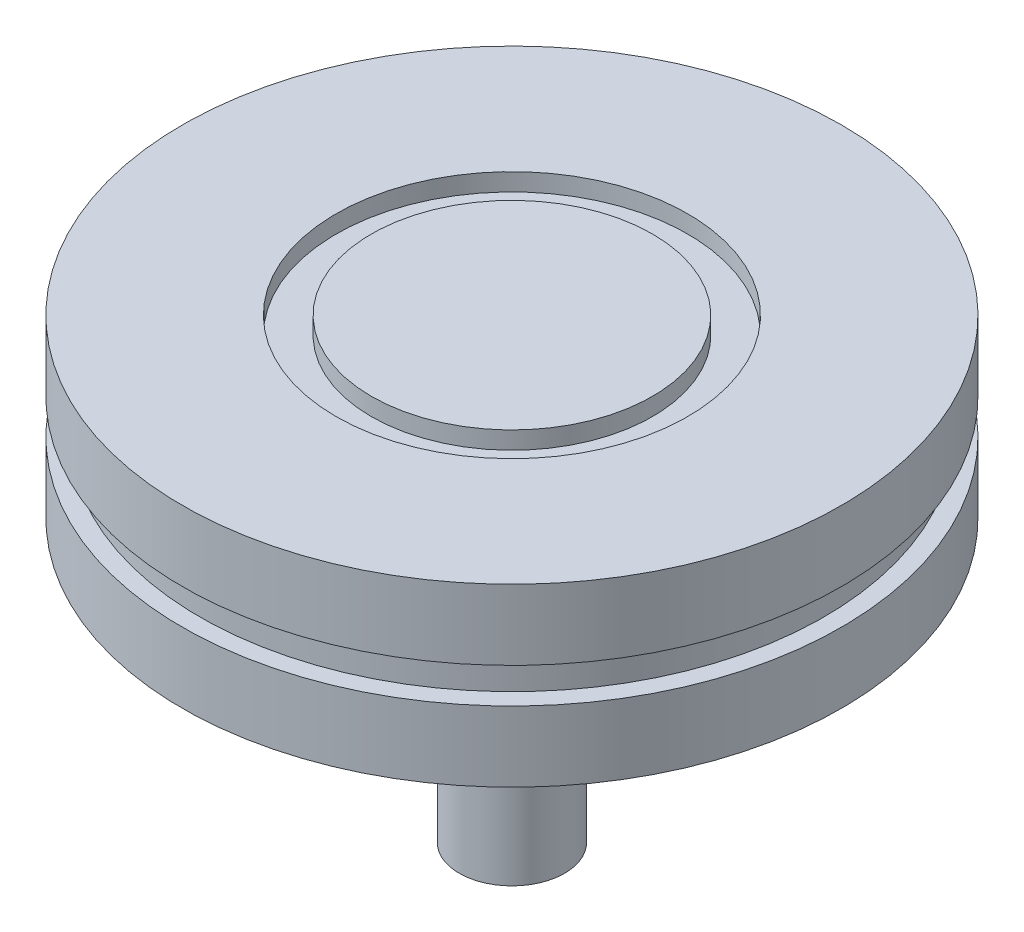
SolidWorks part; units mm, degrees
ref_plane "Front" through (0, 0, 0) normal (0, 0, 1) x (1, 0, 0)
ref_plane "Top" through (0, 0, 0) normal (0, 1, 0) x (1, 0, 0)
ref_plane "Right" through (0, 0, 0) normal (1, 0, 0) x (0, 0, -1)
sketch "Sketch1" plane through (0, 0, 0) normal (0, 0, 1) x (1, 0, 0)
  line L0 (0, 0) -> (-3.81, 0)
  line L1 (-3.81, 0) -> (-3.81, 20.32)
  line L2 (-3.81, 20.32) -> (-23.8125, 20.32)
  line L3 (-23.8125, 20.32) -> (-23.8125, 25.4)
  line L4 (-23.8125, 25.4) -> (-22.5425, 25.4)
  line L5 (-22.5425, 25.4) -> (-22.5425, 27.94)
  line L6 (-22.5425, 27.94) -> (-23.8125, 27.94)
  line L7 (-23.8125, 27.94) -> (-23.8125, 33.02)
  line L8 (-23.8125, 33.02) -> (0, 33.02)
  line L9 (0, 33.02) -> (0, 0)
  line L10 (0, 0) -> (0, 81.0347) construction
  dimension "D1" = 47.625
  dimension "D2" = 7.62
  dimension "D3" = 12.7
  dimension "D4" = 1.27
  dimension "D5" = 2.54
  dimension "D6" = 20.32
revolve "Revolve1" add sketch "Sketch1" angle 360 about L10
sketch "Sketch4" plane through (0, 0, 0) normal (0, -1, 0) x (-1, 0, 0)
  point P0 (0, 0)
hole_wizard "#10-32 Tapped Hole1" positions "Sketch4" profile "Sketch3" tap size "#10-32" standard "ANSI Inch"
sketch "Sketch3" plane through (0, 0, 0) normal (1, 0, 0) x (0, 0, -1)
  line L0 (0, 0) -> (0, 8.8333)
  line L1 (0, 8.8333) -> (2.0193, 7.62)
  line L2 (2.0193, 7.62) -> (2.0193, 0)
  line L5 (2.0193, 0) -> (0, 0)
  line L10 (0, 8.8333) -> (-2.0193, 7.62) construction
  line L11 (0, -6.35) -> (0, 107.95) construction
  dimension "Tap Drill Dia." = 4.0386
  dimension "Tap Drill Depth" = 7.62
  dimension "Drill Angle" = 118
sketch "Sketch5" plane through (0, 33.02, 0) normal (0, 1, 0) x (1, 0, 0)
  circle A0 centre (0, 0) radius 12.7
  circle A1 centre (0, 0) radius 10.16
  dimension "D1" = 25.4
  dimension "D2" = 2.54
extrude "Cut-Extrude1" cut sketch "Sketch5" against normal blind 1.27
